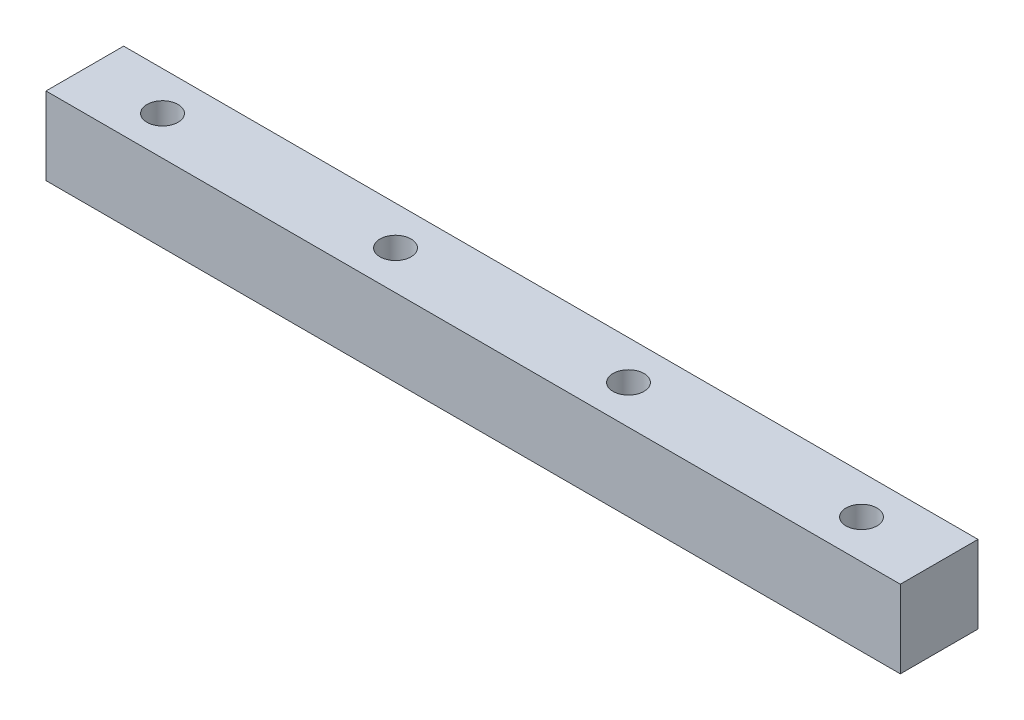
SolidWorks part; units mm, degrees
ref_plane "Plan de face" through (0, 0, 0) normal (0, 0, 1) x (1, 0, 0)
ref_plane "Plan de dessus" through (0, 0, 0) normal (0, 1, 0) x (1, 0, 0)
ref_plane "Plan de droite" through (0, 0, 0) normal (1, 0, 0) x (0, 0, -1)
sketch "Esquisse1" plane through (0, 0, 0) normal (0, 0, 1) x (1, 0, 0)
  line L1 (0, 0) -> (110, 0)
  line L2 (0, 0) -> (0, 10)
  line L3 (0, 10) -> (110, 10)
  line L4 (110, 0) -> (110, 10)
  dimension "D1" = 110
  dimension "D2" = 10
extrude "Boss.-Extru.1" add sketch "Esquisse1" along normal blind 10
sketch "Esquisse2" plane through (0, 10, 0) normal (0, 1, 0) x (1, 0, 0)
  line L0 (0, -10) -> (0, 0) construction
  circle A0 centre (10, -5) radius 2
  dimension "D1" = 4
  dimension "D2" = 10
extrude "Enlèv. mat.-Extru.1" cut sketch "Esquisse2" against normal blind 10
pattern_linear "Répétition linéaire1" count 4 spacing 30 along (1, 0, 0) of "Enlèv. mat.-Extru.1"
